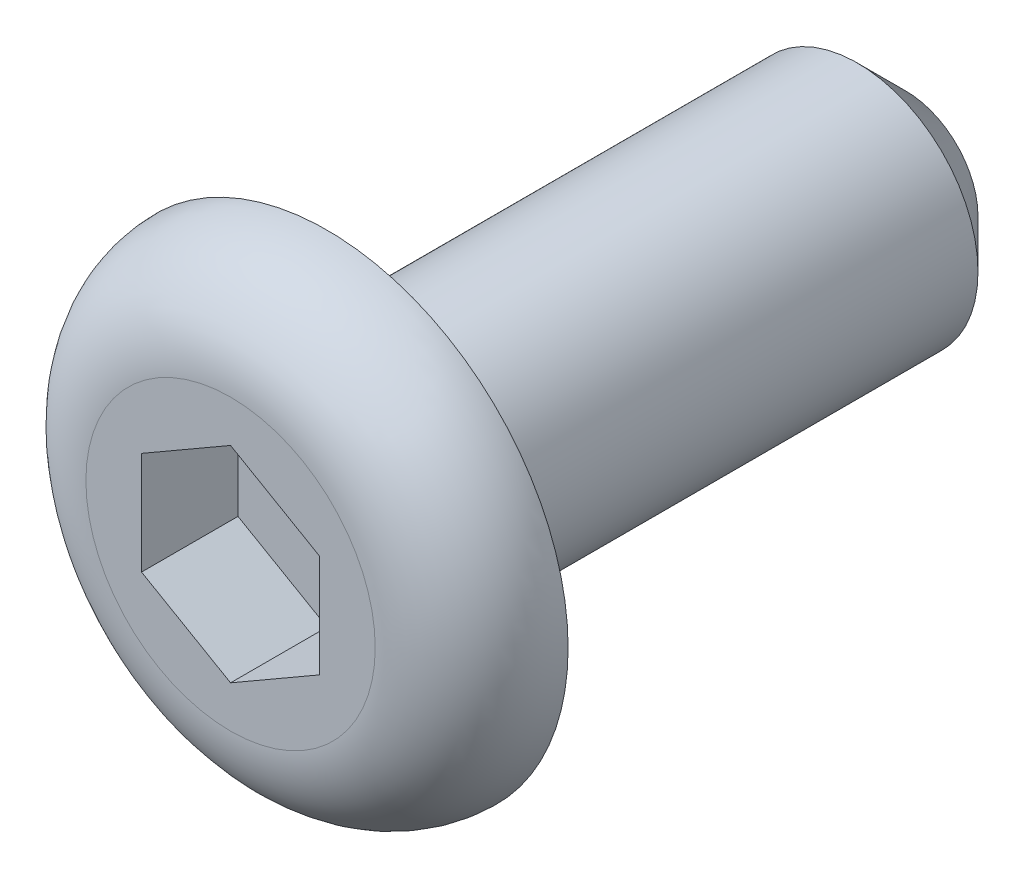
SolidWorks part; units mm, degrees
ref_plane "Front Plane" through (0, 0, 0) normal (0, 0, 1) x (1, 0, 0)
ref_plane "Top Plane" through (0, 0, 0) normal (0, 1, 0) x (1, 0, 0)
ref_plane "Right Plane" through (0, 0, 0) normal (1, 0, 0) x (0, 0, -1)
sketch "Sketch1" plane through (0, 0, 0) normal (0, 0, 1) x (1, 0, 0)
  circle A0 centre (-10.89, 3.0876) radius 1.25
  dimension "D1" = 2.5
extrude "Boss-Extrude1" add sketch "Sketch1" against normal blind 6
sketch "Sketch2" plane through (0, 0, 0) normal (0, 0, 1) x (1, 0, 0)
  circle A0 centre (-10.89, 3.0876) radius 2.5
  dimension "D1" = 5
extrude "Boss-Extrude2" add sketch "Sketch2" along normal blind 1
sketch "Sketch3" plane through (0, 0, 1) normal (0, 0, 1) x (1, 0, 0)
  line L1 (-10.89, 4.1534) -> (-11.8131, 3.6205)
  line L2 (-11.8131, 3.6205) -> (-11.8131, 2.5547)
  line L3 (-11.8131, 2.5547) -> (-10.89, 2.0218)
  line L4 (-10.89, 2.0218) -> (-9.967, 2.5547)
  line L5 (-9.967, 2.5547) -> (-9.967, 3.6205)
  line L6 (-9.967, 3.6205) -> (-10.89, 4.1534)
  circle A0 centre (-10.89, 3.0876) radius 0.923 construction
extrude "Cut-Extrude1" cut sketch "Sketch3" against normal blind 1
fillet "Fillet1" radius 1 1 edges at (-8.39, 3.0876, 1)
chamfer "Chamfer1" distance 0.5 angle 45 1 edges at (-9.64, 3.0876, -6)
